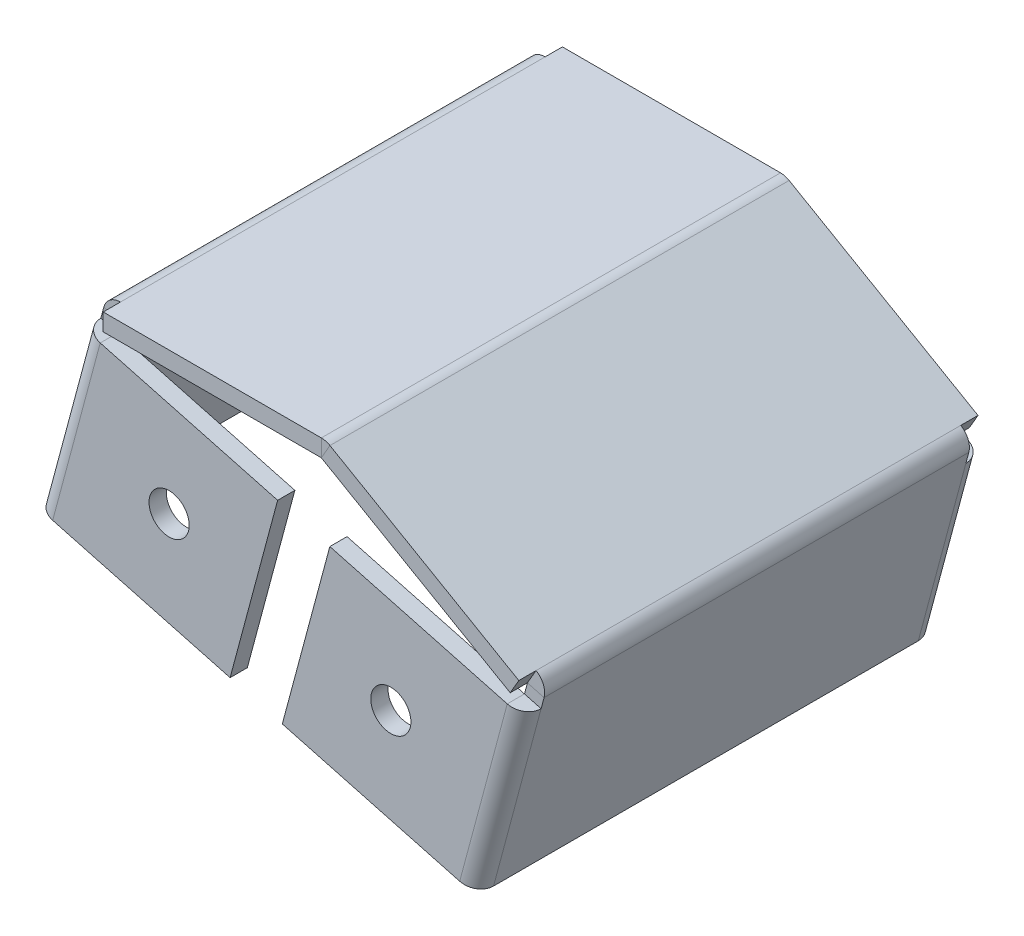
SolidWorks part; units mm, degrees
ref_plane "Front Plane" through (0, 0, 0) normal (0, 0, 1) x (1, 0, 0)
ref_plane "Top Plane" through (0, 0, 0) normal (0, 1, 0) x (1, 0, 0)
ref_plane "Right Plane" through (0, 0, 0) normal (1, 0, 0) x (0, 0, -1)
sketch "Sketch1" plane through (0, 0, 0) normal (0, 1, 0) x (1, 0, 0)
  line L0 (16, 53) -> (16, 69)
  line L1 (0, 0) -> (16, 0)
  line L2 (0, 0) -> (0, 69)
  line L3 (0, 69) -> (16, 69)
  line L4 (16, 0) -> (16, 16)
  line L5 (17, 54.5) -> (55, 54.5)
  line L6 (55, 53) -> (56, 53)
  line L7 (17, 14.5) -> (55, 14.5)
  line L9 (56, 0) -> (72, 0)
  line L10 (56, 0) -> (56, 16)
  line L11 (56, 69) -> (72, 69)
  line L12 (72, 0) -> (72, 69)
  line L13 (56, 53) -> (56, 69)
  line L14 (55, 54.5) -> (55, 53)
  line L17 (16, 53) -> (17, 53)
  line L18 (56, 16) -> (55, 16)
  line L19 (55, 16) -> (55, 14.5)
  line L20 (17, 14.5) -> (17, 16)
  line L21 (17, 16) -> (16, 16)
  line L22 (17, 53) -> (17, 54.5)
  line L23 (0, 34.5) -> (72, 34.5) construction
  circle A0 centre (64, 61.355) radius 1.75
  circle A1 centre (64, 7.645) radius 1.75
  circle A2 centre (8, 7.645) radius 1.75
  circle A3 centre (8, 61.355) radius 1.75
  dimension "D16" = 3.5
  dimension "D18" = 7.645
  dimension "D19" = 7.645
  dimension "D20" = 7.645
  dimension "D21" = 8
  dimension "D22" = 8
  dimension "D23" = 8
  dimension "D24" = 8
  dimension "D1" = 69
  dimension "D2" = 69
  dimension "D3" = 40
  dimension "D4" = 72
  dimension "D5" = 16
  dimension "D6" = 1
  dimension "D7" = 1
  dimension "D8" = 1
  dimension "D9" = 1
  dimension "D10" = 1.5
  dimension "D11" = 1.5
  dimension "D12" = 1.5
  dimension "D13" = 1.5
  dimension "D14" = 40
  dimension "D15" = 20
  dimension "D17" = 7.645
sheet metal parameters "Sheet-Metal1" thickness 1.5 parameters "D1"=1
base flange "Base-Flange1" sketch "Sketch1" thickness 1.5 reverse thickness direction yes parameters "D1"=1
sketch "Sketch3" plane through (0, 1.5, 0) normal (0, 1, 0) x (1, 0, 0)
  line L0 (36, 54.5) -> (36, 14.5)
  line L1 (55, 54.5) -> (17, 54.5) construction
  line L2 (17, 14.5) -> (55, 14.5) construction
sketched bend "Sketched Bend1" parameters "D1"=0.001
bend "SketchBend1" bend radius 0.001 bend angle 30 parameters "D5"=1
sketch "Sketch4" plane through (9.7501, 16.8876, 0) normal (0.5, 0.866, 0) x (0.866, -0.5, 0)
  line L0 (51.1769, 53) -> (67.1769, 53)
  line L1 (67.1769, 0) -> (67.1769, 69) construction
  line L2 (51.1769, 16) -> (67.1769, 16)
sketched bend "Sketched Bend2" parameters "D1"=0
bend "SketchBend2" bend radius 0 bend angle 90 parameters "D5"=2
bend "SketchBend3" bend radius 0 bend angle 90 parameters "D5"=3
sketch "Sketch5" plane through (0, 1.5, 0) normal (0, 1, 0) x (1, 0, 0)
  line L0 (16, 53) -> (0, 53)
  line L1 (0, 69) -> (0, 0) construction
  line L2 (16, 16) -> (0, 16)
sketched bend "Sketched Bend3" parameters "D1"=0
bend "SketchBend4" bend radius 0 bend angle 90 parameters "D5"=4
bend "SketchBend5" bend radius 0 bend angle 90 parameters "D5"=5
sketch "Sketch6" plane through (9.7501, 16.8876, 0) normal (0.5, 0.866, 0) x (0.866, -0.5, 0)
  line L0 (50.1769, 53) -> (50.1769, 16)
sketched bend "Sketched Bend4" parameters "D1"=0.001
bend "SketchBend6" bend radius 0.001 bend angle 75 parameters "D5"=6
sketch "Sketch7" plane through (0, 1.5, 0) normal (0, 1, 0) x (1, 0, 0)
  line L0 (17, 53) -> (17, 16)
sketched bend "Sketched Bend5" parameters "D1"=0.001
bend "SketchBend7" bend radius 0.001 bend angle 75 parameters "D5"=7
flat pattern "Flat-Pattern1"
sketch "Bend-Lines1" plane through (0, 0, 0) normal (0, 1, 0) x (-1, 0, 0)
bend of the flat pattern "Flatten-<SketchBend1>1"
bend of the flat pattern "Flatten-<SketchBend2>1"
bend of the flat pattern "Flatten-<SketchBend3>1"
bend of the flat pattern "Flatten-<SketchBend4>1"
bend of the flat pattern "Flatten-<SketchBend5>1"
bend of the flat pattern "Flatten-<SketchBend6>1"
bend of the flat pattern "Flatten-<SketchBend7>1"
